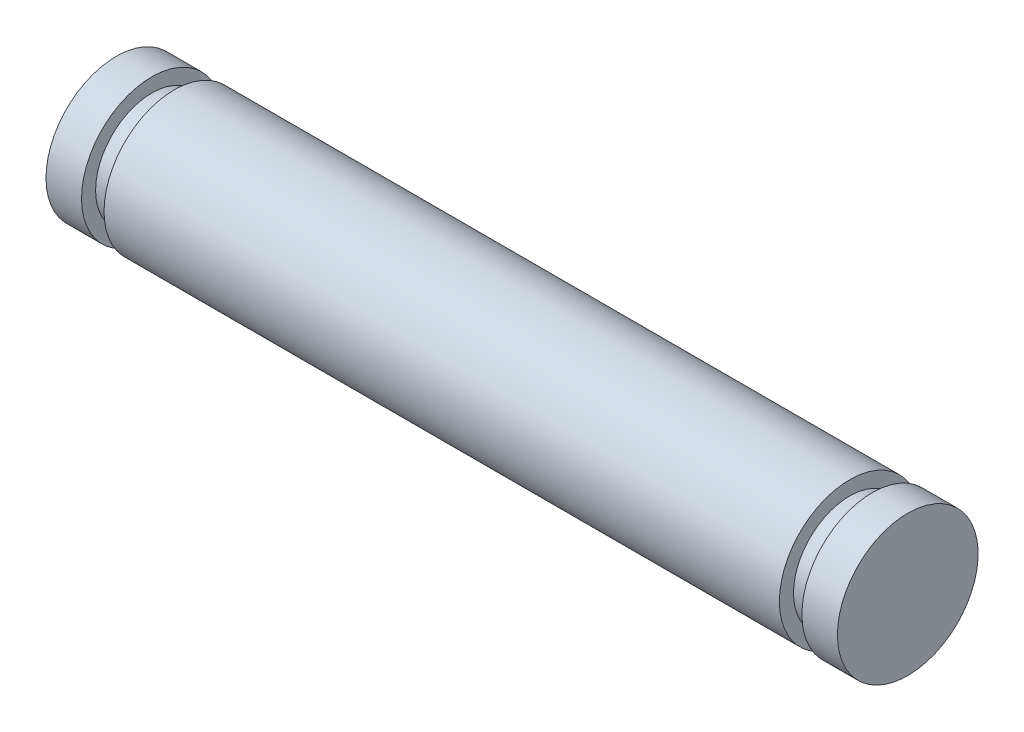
SolidWorks part; units mm, degrees
ref_plane "Front Plane" through (0, 0, 0) normal (0, 0, 1) x (1, 0, 0)
ref_plane "Top Plane" through (0, 0, 0) normal (0, 1, 0) x (1, 0, 0)
ref_plane "Right Plane" through (0, 0, 0) normal (1, 0, 0) x (0, 0, -1)
sketch "Sketch1" plane through (0, 0, 0) normal (1, 0, 0) x (0, 0, -1)
  circle A0 centre (0, 0) radius 2
  dimension "D1" = 4
extrude "Boss-Extrude1" add sketch "Sketch1" along normal mid plane 22.5
ref_axis "Axis1" through (-12.375, 0, 0) along (1, 0, 0)
sketch "Sketch3" plane through (0, 0, 0) normal (0, 1, 0) x (1, 0, 0)
  line L0 (11.25, 2) -> (-11.25, 2) construction
  line L1 (-10.24, 2) -> (-9.6, 2)
  line L2 (-10.24, 2) -> (-10.24, 1.6)
  line L3 (-10.24, 1.6) -> (-9.6, 1.6)
  line L4 (-9.6, 2) -> (-9.6, 1.6)
  line L5 (-12.375, 0) -> (12.375, 0) construction
  dimension "D1" = 0.64
  dimension "D2" = 1.6
  dimension "D3" = 9.6
revolve "Cut-Revolve1" cut sketch "Sketch3" angle 360 about axis through (-12.375, 0, 0) along (1, 0, 0)
mirror "Mirror1" about plane through (0, 0, 0) normal (1, 0, 0) of "Cut-Revolve1"
